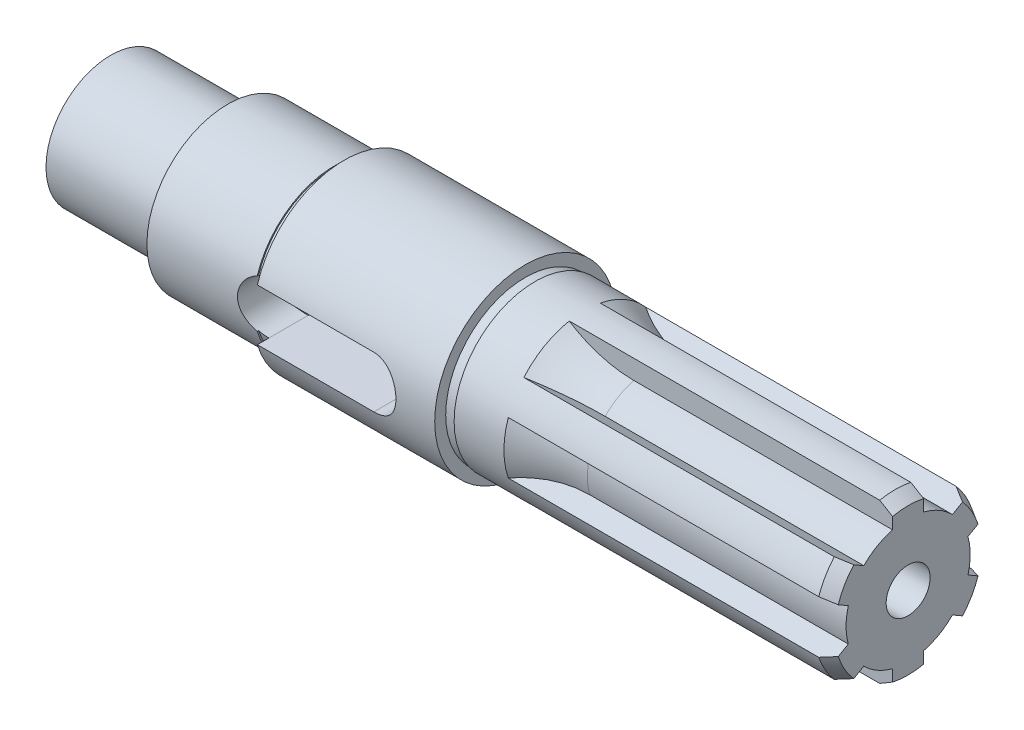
SolidWorks part; units mm, degrees
ref_plane "Plan de face" through (0, 0, 0) normal (0, 0, 1) x (1, 0, 0)
ref_plane "Plan de dessus" through (0, 0, 0) normal (0, 1, 0) x (1, 0, 0)
ref_plane "Plan de droite" through (0, 0, 0) normal (1, 0, 0) x (0, 0, -1)
sketch "Esquisse1" plane through (0, 0, 0) normal (0, 0, 1) x (1, 0, 0)
  line L0 (0, 0) -> (150.6872, 0) construction
  line L1 (74, 5) -> (76.8868, 0)
  line L2 (74, 5) -> (1, 5)
  line L3 (1, 5) -> (0, 6)
  line L4 (0, 6) -> (0, 10)
  line L5 (0, 10) -> (18.1, 10)
  line L6 (18.1, 10) -> (18.1, 12.5)
  line L7 (18.1, 12.5) -> (34.6, 12.5)
  line L8 (34.6, 12.5) -> (34.6, 12.3)
  line L9 (34.6, 12.3) -> (36.1, 12.3)
  line L10 (36.1, 12.3) -> (36.1, 14)
  line L11 (36.1, 14) -> (64.1, 14)
  line L12 (64.1, 12.3) -> (64.1, 14)
  line L13 (64.1, 12.3) -> (65.6, 12.3)
  line L14 (65.6, 12.3) -> (65.6, 12.5)
  line L15 (65.6, 12.5) -> (73.3, 12.5)
  line L16 (123.3, 0) -> (123.3, 9.6)
  line L18 (123.3, 9.6) -> (83.3, 9.6)
  line L19 (76.8868, 0) -> (123.3, 0)
  arc A0 (83.3, 9.6) -> (73.3, 12.5) centre (83.3, 28.2914) cw
  dimension "D3" = 40
  dimension "D4" = 50
  dimension "D5" = 19.2
  dimension "D6" = 25
  dimension "D7" = 1.5
  dimension "D8" = 24.6
  dimension "D9" = 28
  dimension "D10" = 28
  dimension "D11" = 1.5
  dimension "D12" = 36.1
  dimension "D13" = 18.1
  dimension "D14" = 25
  dimension "D15" = 20
  dimension "D16" = 10
  dimension "D17" = 45
  dimension "D18" = 1
  dimension "D19" = 120
  dimension "D20" = 74
  dimension "D21" = 123.3
revolve "Révolution1" add sketch "Esquisse1" angle 360 about L0
sketch "Esquisse2" plane through (123.3, 0, 0) normal (1, 0, 0) x (0, 0, -1)
  line L0 (-2.4, 9.2952) -> (-2.4, 12.2674)
  line L1 (2.4, 9.2952) -> (2.4, 12.2674)
  line L2 (-2.4, 9.2952) -> (-2.4, 12.2674)
  line L3 (2.4, 9.2952) -> (2.4, 12.2674)
  line L4 (-9.2498, 2.5691) -> (-11.8239, 4.0553)
  line L5 (-6.8498, 6.726) -> (-9.4239, 8.2122)
  line L6 (-6.8498, -6.726) -> (-9.4239, -8.2122)
  line L7 (-9.2498, -2.5691) -> (-11.8239, -4.0553)
  line L8 (2.4, -9.2952) -> (2.4, -12.2674)
  line L9 (-2.4, -9.2952) -> (-2.4, -12.2674)
  line L10 (9.2498, -2.5691) -> (11.8239, -4.0553)
  line L11 (6.8498, -6.726) -> (9.4239, -8.2122)
  line L12 (6.8498, 6.726) -> (9.4239, 8.2122)
  line L13 (9.2498, 2.5691) -> (11.8239, 4.0553)
  circle A0 centre (0, 0) radius 12.5 construction
  arc A1 (2.4, 12.2674) -> (-2.4, 12.2674) centre (0, 0) ccw
  arc A3 (-9.2498, 2.5691) -> (-9.2498, -2.5691) centre (0, 0) ccw
  arc A4 (2.4, 12.2674) -> (-2.4, 12.2674) centre (0, 0) ccw
  arc A5 (-9.4239, 8.2122) -> (-11.8239, 4.0553) centre (0, 0) ccw
  arc A6 (-11.8239, -4.0553) -> (-9.4239, -8.2122) centre (0, 0) ccw
  arc A7 (-2.4, -12.2674) -> (2.4, -12.2674) centre (0, 0) ccw
  arc A8 (9.4239, -8.2122) -> (11.8239, -4.0553) centre (0, 0) ccw
  arc A9 (11.8239, 4.0553) -> (9.4239, 8.2122) centre (0, 0) ccw
  arc A10 (-6.8498, -6.726) -> (-2.4, -9.2952) centre (0, 0) ccw
  arc A11 (6.8498, 6.726) -> (2.4, 9.2952) centre (0, 0) ccw
  arc A12 (9.2498, -2.5691) -> (9.2498, 2.5691) centre (0, 0) ccw
  arc A13 (2.4, -9.2952) -> (6.8498, -6.726) centre (0, 0) ccw
  circle A16 centre (0, 0) radius 9.6
  arc A17 (-2.4, 9.2952) -> (-6.8498, 6.726) centre (0, 0) ccw
  dimension "D1" = 4.8
  dimension "D2" = 2.4
  dimension "D3" = 0
extrude "Extrusion1" add sketch "Esquisse2" against normal up to next
chamfer "Chanfrein1" distance 2 angle 30 6 edges at (123.3, 6.25, -10.8253) (123.3, -6.25, -10.8253) (123.3, -12.5, 0) (123.3, -6.25, 10.8253) (123.3, 6.25, 10.8253) (123.3, 12.5, 0)
sketch "Esquisse3" plane through (0, 0, 0) normal (0, 0, 1) x (1, 0, 0)
  line L0 (64.1, -14) -> (64.1, 14) construction
  line L2 (54.1, 4) -> (36.1, 4)
  line L3 (36.1, -4) -> (54.1, -4)
  arc A0 (36.1, 4) -> (36.1, -4) centre (36.1, 0) ccw
  arc A1 (54.1, -4) -> (54.1, 4) centre (54.1, 0) ccw
  dimension "D1" = 8
  dimension "D2" = 8
  dimension "D4" = 18
  dimension "D3" = 10
extrude "Enlèv. mat.-Extru.1" cut sketch "Esquisse3" against normal mid plane 47
ref_plane "Plan1" through (0, 0, 9.6) normal (0, 0, 1) x (1, 0, 0)
sketch "Esquisse4" plane through (0, 0, 9.6) normal (0, 0, 1) x (1, 0, 0)
  line L0 (123.3, -2.5691) -> (123.3, 2.5691) construction
  line L1 (121.3, 0) -> (65.6, 0) construction
  circle A0 centre (108.3, 0) radius 2.95
  point P6 (108.3, 0)
  dimension "D1" = 5.9
  dimension "D2" = 15
extrude "Enlèv. mat.-Extru.2" [suppressed] cut sketch "Esquisse4" against normal blind 5
sketch "Esquisse5" [suppressed] plane through (0, 0, 4.6) normal (0, 0, 1) x (1, 0, 0)
  circle A1 centre (107.3, 0) radius 2.95
  circle A2 centre (107.3, 0) radius 2.95
  dimension "D1" = 0
extrude "Enlèv. mat.-Extru.3" [suppressed] cut sketch "Esquisse5" against normal blind 2 draft 56
hole_wizard "Trou taraudé M81" positions "Esquisse7" profile "Esquisse6" tap size "M8" standard "ISO"
sketch "Esquisse7" plane through (123.3, 0, 0) normal (1, 0, 0) x (0, 0, -1)
  point P0 (0, 0)
sketch "Esquisse6" plane through (123.3, 0, 0) normal (0, 1, 0) x (0, 0, -1)
  line L0 (0, 0) -> (0, 21.7929)
  line L1 (0, 21.7929) -> (3.4, 19.75)
  line L2 (3.4, 19.75) -> (3.4, 0)
  line L5 (3.4, 0) -> (0, 0)
  line L10 (0, 21.7929) -> (-3.4, 19.75) construction
  line L11 (0, -6.35) -> (0, 107.95) construction
  dimension "Diamètre du trou pour taraudage" = 6.8
  dimension "Profondeur du trou pour taraudage" = 19.75
  dimension "Angle de pointe" = 118
sketch "Esquisse8" plane through (0, 0, 0) normal (-1, 0, 0) x (0, 0, 1)
  circle A0 centre (0, 0) radius 6.85 construction
  circle A1 centre (0, 0) radius 6.85
extrude "Enlèv. mat.-Extru.4" cut sketch "Esquisse8" against normal blind 36.1
